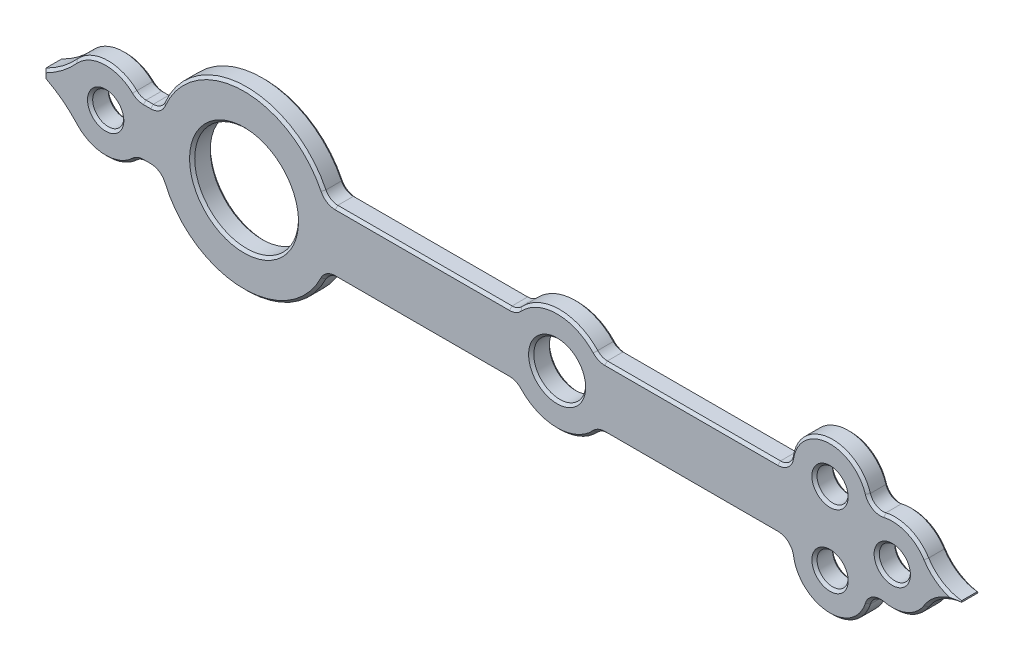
SolidWorks part; units mm, degrees
ref_plane "Спереди" through (0, 0, 0) normal (0, 0, 1) x (1, 0, 0)
ref_plane "Сверху" through (0, 0, 0) normal (0, 1, 0) x (1, 0, 0)
ref_plane "Справа" through (0, 0, 0) normal (1, 0, 0) x (0, 0, -1)
sketch "Эскиз1" plane through (0, 0, 0) normal (0, 0, 1) x (1, 0, 0)
  line L0 (-49.5095, -0.4) -> (-49.5095, 0)
  line L1 (26.3, 3.5) -> (32.3, 3.5) construction
  line L2 (26.3, 3.5) -> (26.3, 0) construction
  line L3 (26.3, 0) -> (32.3, 0) construction
  line L4 (32.3, 3.5) -> (32.3, 0) construction
  line L150 (-30.1745, 5) -> (-30.1745, 0) construction
  line L151 (-43.5095, 0) -> (-43.5095, 1.5) construction
  line L152 (-4.5913, -3) -> (-21.387, -3)
  line L153 (-39.171, -2.54) -> (-39.8685, -2.54)
  line L154 (21.2787, -3) -> (4.5913, -3)
  line L284 (0, -2.5) -> (0, 0) construction
  line L354 (38.7405, -0.07) -> (38.7405, 0.07)
  line L637 (21.2787, 3) -> (4.5913, 3)
  line L747 (-4.5913, 3) -> (-21.387, 3)
  line L901 (-39.171, 2.54) -> (-39.8685, 2.54)
  line L1004 (-49.5095, 0.4) -> (-49.5095, 0)
  line L1209 (-49.5095, 0) -> (38.7405, 0) construction
  line L1210 (32.3, 1.5) -> (32.3, 0) construction
  circle A0 centre (32.3, 0) radius 1.5
  circle A1 centre (0, 0) radius 2.5
  circle A2 centre (-30.1745, 0) radius 5
  circle A3 centre (-43.5095, 0) radius 1.5
  arc A4 (-46.4774, -2.6817) -> (-40.7459, -2.8918) centre (-43.5095, 0) ccw
  arc A5 (-49.5095, 0.4) -> (-46.4774, 2.6817) centre (-53.8971, 9.386) ccw
  arc A6 (-49.5095, -0.4) -> (-46.4774, -2.6817) centre (-53.8971, -9.386) cw
  arc A7 (-38.0015, -3.3147) -> (-22.5293, -3.7149) centre (-30.1745, 0) ccw
  arc A8 (-40.7459, 2.8918) -> (-46.4774, 2.6817) centre (-43.5095, 0) ccw
  arc A9 (-38.0015, 3.3147) -> (-39.171, 2.54) centre (-39.171, 3.81) cw
  arc A10 (-39.8685, 2.54) -> (-40.7459, 2.8918) centre (-39.8685, 3.81) cw
  arc A11 (-22.5293, 3.7149) -> (-38.0015, 3.3147) centre (-30.1745, 0) ccw
  arc A12 (-21.387, 3) -> (-22.5293, 3.7149) centre (-21.387, 4.27) cw
  arc A13 (-21.387, -3) -> (-22.5293, -3.7149) centre (-21.387, -4.27) ccw
  arc A14 (-38.0015, -3.3147) -> (-39.171, -2.54) centre (-39.171, -3.81) ccw
  arc A15 (-39.8685, -2.54) -> (-40.7459, -2.8918) centre (-39.8685, -3.81) ccw
  arc A16 (-3.6613, -3.4051) -> (3.6613, -3.4051) centre (0, 0) ccw
  arc A17 (-4.5913, 3) -> (-3.6613, 3.4051) centre (-4.5913, 4.27) ccw
  arc A18 (3.6613, 3.4051) -> (-3.6613, 3.4051) centre (0, 0) ccw
  arc A19 (4.5913, 3) -> (3.6613, 3.4051) centre (4.5913, 4.27) cw
  arc A20 (-4.5913, -3) -> (-3.6613, -3.4051) centre (-4.5913, -4.27) cw
  arc A21 (4.5913, -3) -> (3.6613, -3.4051) centre (4.5913, -4.27) ccw
  circle A22 centre (26.3, 3.5) radius 1.5
  arc A23 (29.9423, -4.618) -> (31.44, -3.7527) centre (31.1564, -4.9906) cw
  arc A24 (21.2787, 3) -> (22.534, 4.0775) centre (21.2787, 4.27) ccw
  arc A25 (21.2787, -3) -> (22.534, -4.0775) centre (21.2787, -4.27) cw
  arc A26 (31.44, 3.7527) -> (29.9423, 4.618) centre (31.1564, 4.9906) cw
  circle A27 centre (26.3, -3.5) radius 1.5
  arc A28 (31.44, -3.7527) -> (35.5631, -2.0432) centre (32.3, 0) ccw
  arc A29 (29.9423, -4.618) -> (22.534, -4.0775) centre (26.3, -3.5) cw
  arc A30 (35.5631, 2.0432) -> (38.7405, 0.07) centre (39.1652, 4.2987) ccw
  arc A31 (29.9423, 4.618) -> (22.534, 4.0775) centre (26.3, 3.5) ccw
  arc A32 (35.5631, -2.0432) -> (38.7405, -0.07) centre (39.1652, -4.2987) cw
  arc A33 (35.5631, 2.0432) -> (31.44, 3.7527) centre (32.3, 0) ccw
  point P176 (-22.2215, 3)
  point P191 (4, 3)
  dimension "D1" = 3
  dimension "D2" = 5
  dimension "D4" = 10
  dimension "D6" = 3
  dimension "D10" = 8
  dimension "D12" = 20
  dimension "D14" = 17
  dimension "D15" = 1.27
  dimension "D16" = 1.27
  dimension "D18" = 10
  dimension "D19" = 1.27
  dimension "D20" = 1.27
  dimension "D23" = 1.27
  dimension "D24" = 1.27
  dimension "D25" = 7.7
  dimension "D27" = 8.5
  dimension "D28" = 3.81
  dimension "D3" = 32.3
  dimension "D5" = 30.1745
  dimension "D7" = 13.335
  dimension "D8" = 88.25
  dimension "D9" = 6
  dimension "D11" = 0.4
  dimension "D13" = 2.54
  dimension "D17" = 6
  dimension "D21" = 6
  dimension "D22" = 3.5
  dimension "D26" = 0.07
extrude "Бобышка-Вытянуть2" add sketch "Эскиз1" along normal blind 2
chamfer "Фаска1" distance 0.25 angle 45 82 edges at (2.5, 0, 0) (-42.0095, 0, 0) (24.8, -3.5, 0) (30.5211, -3.891, 0) (33.7746, -3.5564, 0) (36.9231, -0.6883, 0) (36.9231, 0.6883, 0) (33.7746, 3.5564, 0) (30.5211, 3.891, 0) (26.0228, 7.2999, 0) (22.1059, 3.3063, 0) (12.935, 3, 0) (4.0841, 3.1057, 0) (0, 5, 0) (-4.0841, 3.1057, 0) (-12.9892, 3, 0) (-22.0608, 3.1935, 0) (-30.3943, 8.4972, 0) (-38.4696, 2.7513, 0) (-39.5197, 2.54, 0) (-40.3412, 2.6312, 0) (-43.656, 3.9973, 0) (-47.8842, 1.3957, 0) (-49.5095, 0, 0) (-47.8842, -1.3957, 0) (-43.656, -3.9973, 0) (-40.3412, -2.6312, 0) (-39.5197, -2.54, 0) (-38.4696, -2.7513, 0) (-30.3943, -8.4972, 0) (-22.0608, -3.1935, 0) (-12.9892, -3, 0) (-4.0841, -3.1057, 0) (0, -5, 0) (4.0841, -3.1057, 0) (12.935, -3, 0) (22.1059, -3.3063, 0) (26.0228, -7.2999, 0) (33.8, 0, 0) (-25.1745, 0, 0) (27.8, 3.5, 0) (2.5, 0, 2) (-42.0095, 0, 2) (24.8, -3.5, 2) (22.1059, -3.3063, 2) (12.935, -3, 2) (4.0841, -3.1057, 2) (0, -5, 2) (-4.0841, -3.1057, 2) (-12.9892, -3, 2) (-22.0608, -3.1935, 2) (-30.3943, -8.4972, 2) (-38.4696, -2.7513, 2) (-39.5197, -2.54, 2) (-40.3412, -2.6312, 2) (-43.656, -3.9973, 2) (-47.8842, -1.3957, 2) (-49.5095, 0, 2) (-47.8842, 1.3957, 2) (-43.656, 3.9973, 2) (-40.3412, 2.6312, 2) (-39.5197, 2.54, 2) (-38.4696, 2.7513, 2) (-30.3943, 8.4972, 2) (-22.0608, 3.1935, 2) (-12.9892, 3, 2) (-4.0841, 3.1057, 2) (0, 5, 2) (4.0841, 3.1057, 2) (12.935, 3, 2) (22.1059, 3.3063, 2) (26.0228, 7.2999, 2) (30.5211, 3.891, 2) (33.7746, 3.5564, 2) (36.9231, 0.6883, 2) (36.9231, -0.6883, 2) (33.7746, -3.5564, 2) (30.5211, -3.891, 2) (26.0228, -7.2999, 2) (33.8, 0, 2) (-25.1745, 0, 2) (27.8, 3.5, 2)
